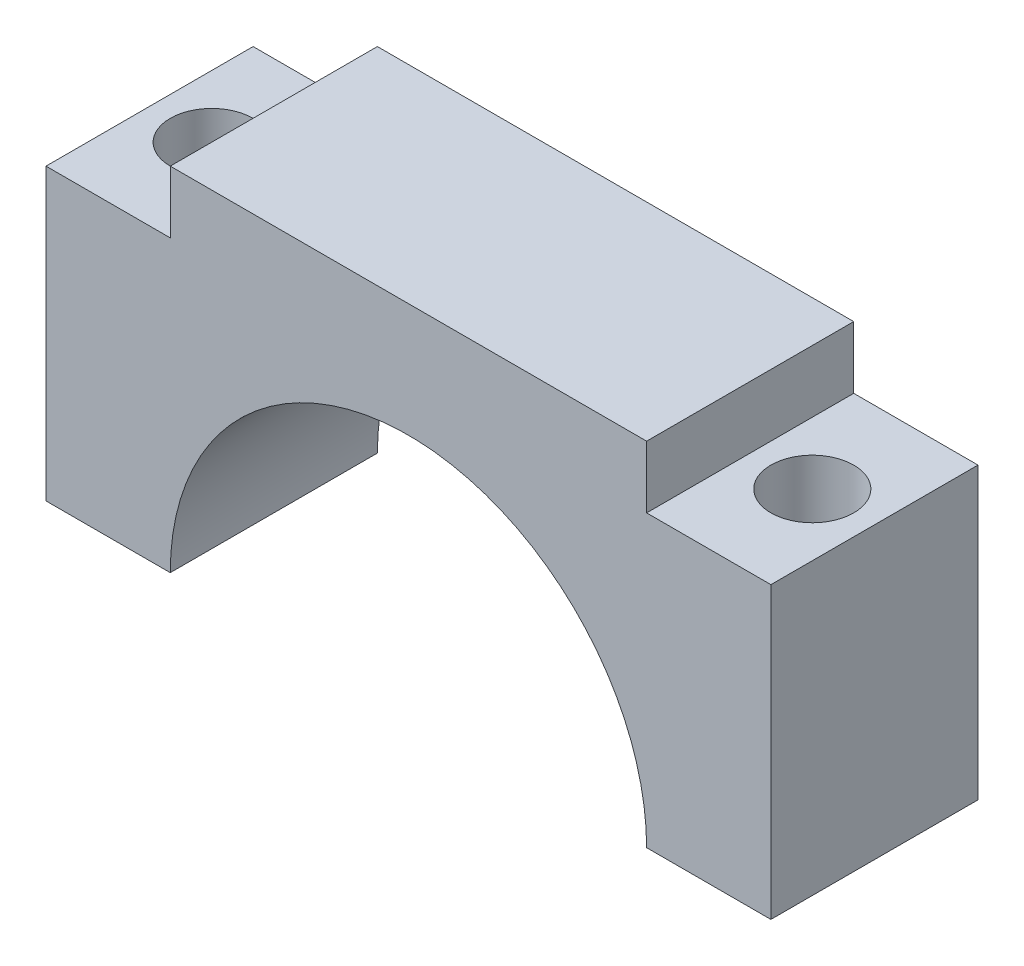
SolidWorks part; units mm, degrees
ref_plane "Plan de face" through (0, 0, 0) normal (0, 0, 1) x (1, 0, 0)
ref_plane "Plan de dessus" through (0, 0, 0) normal (0, 1, 0) x (1, 0, 0)
ref_plane "Plan de droite" through (0, 0, 0) normal (1, 0, 0) x (0, 0, -1)
sketch "Esquisse1" plane through (0, 0, 0) normal (0, 0, 1) x (1, 0, 0)
  line L1 (-40.2821, 13.7885) -> (-5.2821, 13.7885)
  line L2 (-40.2821, 13.7885) -> (-40.2821, -3.2115)
  line L3 (-40.2821, -3.2115) -> (-5.2821, -3.2115)
  line L4 (-5.2821, 13.7885) -> (-5.2821, -3.2115)
  dimension "D1" = 35
  dimension "D2" = 17
extrude "Boss.-Extru.1" add sketch "Esquisse1" along normal blind 10
sketch "Esquisse2" plane through (0, 0, 10) normal (0, 0, 1) x (1, 0, 0)
  line L0 (-22.7821, -3.2115) -> (-22.7821, 13.7885) construction
  line L1 (-40.2821, -3.2115) -> (-5.2821, -3.2115) construction
  line L2 (-5.2821, 13.7885) -> (-40.2821, 13.7885) construction
  line L3 (-34.2821, -3.2115) -> (-11.2821, -3.2115)
  arc A0 (-11.2821, -3.2115) -> (-34.2821, -3.2115) centre (-22.7821, -3.2115) ccw
  dimension "D1" = 11.5
extrude "Enlèv. mat.-Extru.1" cut sketch "Esquisse2" against normal blind 10
sketch "Esquisse3" plane through (0, -3.2115, 0) normal (0, -1, 0) x (-1, 0, 0)
  line L0 (5.2821, 0) -> (11.2821, -10) construction
  line L1 (11.2821, 0) -> (5.2821, -10) construction
  line L2 (34.2821, 0) -> (40.2821, -10) construction
  line L3 (40.2821, 0) -> (34.2821, -10) construction
  circle A0 centre (8.2821, -5) radius 2
  circle A1 centre (37.2821, -5) radius 2
extrude "Enlèv. mat.-Extru.2" cut sketch "Esquisse3" against normal through all
sketch "Esquisse4" plane through (0, 13.7885, 0) normal (0, 1, 0) x (1, 0, 0)
  line L0 (-11.2821, 0) -> (-5.2821, 0)
  line L1 (-5.2821, 0) -> (-40.2821, 0) construction
  line L2 (-5.2821, 0) -> (-5.2821, -10)
  line L3 (-5.2821, -10) -> (-11.2821, -10)
  line L4 (-5.2821, -10) -> (-40.2821, -10) construction
  line L5 (-11.2821, -10) -> (-11.2821, 0)
  line L6 (-22.7821, 0) -> (-22.7821, -10) construction
  line L7 (-34.2821, -10) -> (-34.2821, 0)
  line L8 (-40.2821, -10) -> (-34.2821, -10)
  line L9 (-40.2821, 0) -> (-40.2821, -10)
  line L10 (-34.2821, 0) -> (-40.2821, 0)
  dimension "D1" = 6
  dimension "D2" = 6
extrude "Enlèv. mat.-Extru.3" cut sketch "Esquisse4" against normal blind 3
